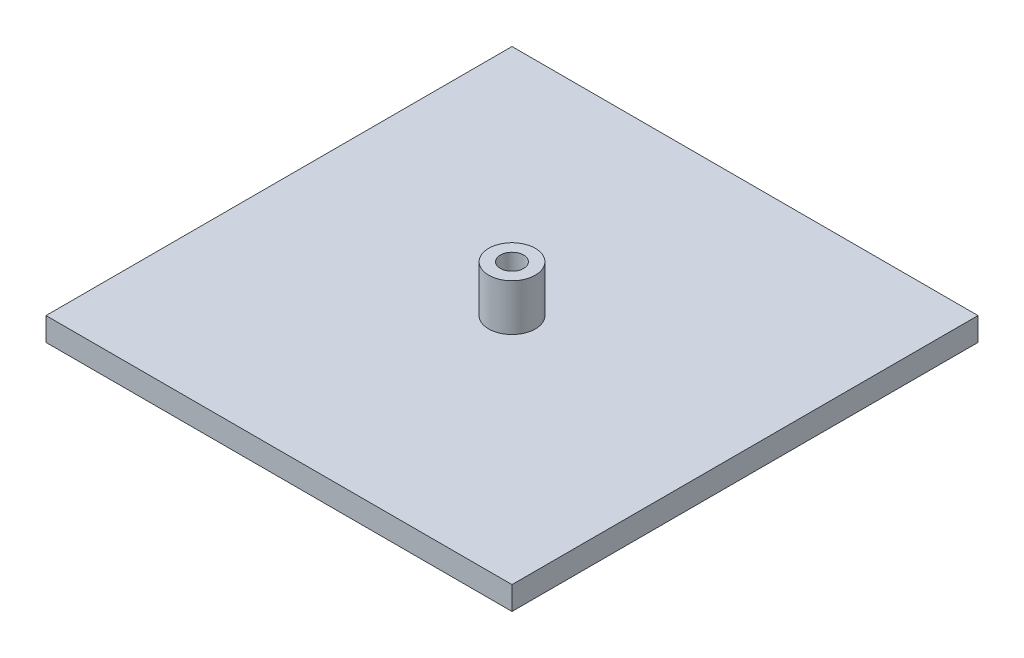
SolidWorks part; units mm, degrees
ref_plane "Plan de face" through (0, 0, 0) normal (0, 0, 1) x (1, 0, 0)
ref_plane "Plan de dessus" through (0, 0, 0) normal (0, 1, 0) x (1, 0, 0)
ref_plane "Plan de droite" through (0, 0, 0) normal (1, 0, 0) x (0, 0, -1)
sketch "Esquisse1" plane through (0, 0, 0) normal (0, 1, 0) x (1, 0, 0)
  line L1 (-10, -10) -> (10, -10)
  line L2 (-10, -10) -> (-10, 10)
  line L3 (-10, 10) -> (10, 10)
  line L4 (10, -10) -> (10, 10)
  line L5 (-10, -10) -> (10, 10) construction
  line L6 (-10, 10) -> (10, -10) construction
  circle A0 centre (0, 0) radius 0.5
  point P0 (0, 0)
extrude "Boss.-Extru.1" add sketch "Esquisse1" along normal blind 1
sketch "Esquisse2" plane through (0, 1, 0) normal (0, 1, 0) x (1, 0, 0)
  line L0 (0, 10.5897) -> (0, -2.7166) construction
  line L1 (10.5143, 0) -> (-2.2135, 0) construction
  circle A0 centre (0, 0) radius 1
  circle A1 centre (0, 0) radius 0.5
extrude "Boss.-Extru.2" add sketch "Esquisse2" along normal blind 2
